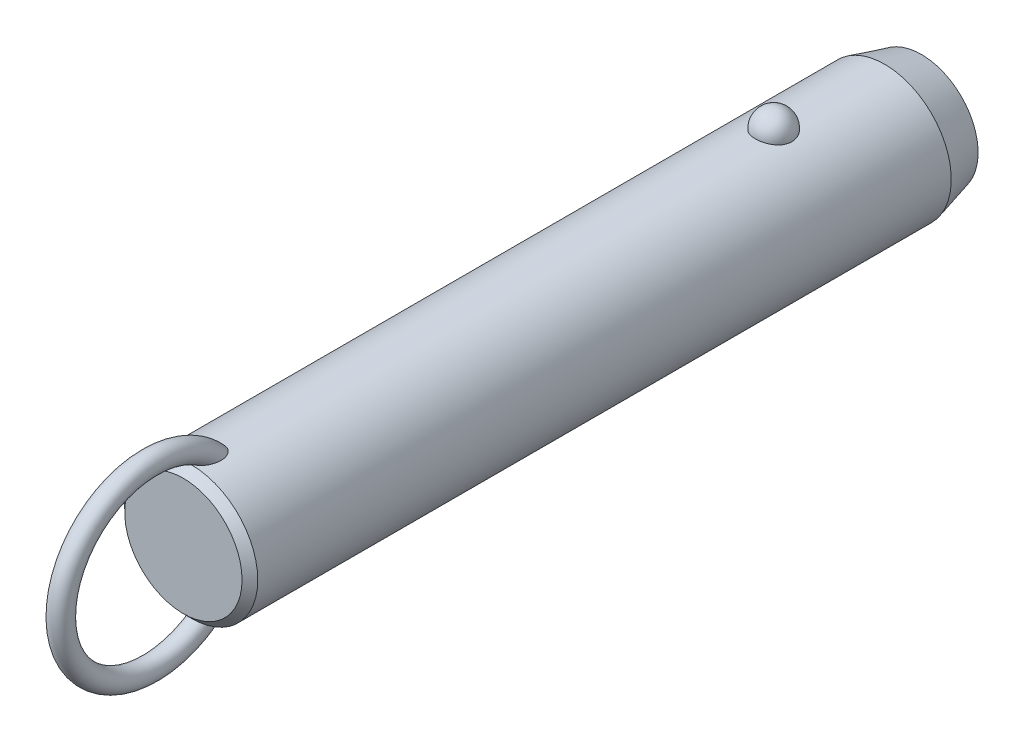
SolidWorks part; units mm, degrees
ref_plane "Front Plane" through (0, 0, 0) normal (0, 0, 1) x (1, 0, 0)
ref_plane "Top Plane" through (0, 0, 0) normal (0, 1, 0) x (1, 0, 0)
ref_plane "Right Plane" through (0, 0, 0) normal (1, 0, 0) x (0, 0, -1)
sketch "Sketch2" plane through (0, 0, 0) normal (0, 0, 1) x (1, 0, 0)
  circle A0 centre (0, 0) radius 12.7
  point P3 (0, 12.7)
  dimension "D1" = 25.4
extrude "Boss-Extrude1" add sketch "Sketch2" along normal blind 96.5
sketch "Sketch3" plane through (0, 0, 0) normal (0, 0, -1) x (-1, 0, 0)
  circle A0 centre (0, 0) radius 12.7
  dimension "D1" = 25.4
extrude "Boss-Extrude2" add sketch "Sketch3" along normal blind 31.7
chamfer "Chamfer1" distance 7 angle 15 1 edges at (-12.7, 0, -31.7)
sketch "Sketch12" plane through (0, 0, 0) normal (1, 0, 0) x (0, 0, -1)
  line L0 (-96.5, 12.7) -> (-96.5, -12.7) construction
  point P0 (-96.5, 0)
sketch "Sketch13" plane through (0, 0, 0) normal (1, 0, 0) x (0, 0, -1)
  circle A0 centre (-115.55, 0) radius 19.05
  point P2 (-96.5, 0)
  dimension "D1" = 38.1
sketch "Sketch14" plane through (0, 0, 0) normal (0, 1, 0) x (1, 0, 0)
  circle A0 centre (0, -98.5) radius 2
  point P2 (0, -96.5)
  dimension "D1" = 4
sweep "Sweep1" add profiles "Sketch14" path "Sketch13"
sketch "Sketch15" plane through (0, 0, 96.5) normal (0, 0, 1) x (1, 0, 0)
  circle A0 centre (0, 0) radius 12.7
  dimension "D1" = 25.4
extrude "Boss-Extrude3" add sketch "Sketch15" along normal blind 12.7
chamfer "Chamfer2" distance 1.5 angle 45 1 edges at (12.7, 0, 109.2)
sketch "Sketch18" plane through (0, 0, 0) normal (1, 0, 0) x (0, 0, -1)
  line L0 (24.7, 12.7) -> (-101.351, 12.7) construction
  line L1 (3.5, 16.2) -> (3.5, 9.2)
  line L2 (-101.351, -12.7) -> (24.7, -12.7) construction
  arc A0 (3.5, 16.2) -> (3.5, 9.2) centre (3.5, 12.7) ccw
  point P4 (0, 12.7)
  dimension "D1" = 28.9
revolve "Revolve1" add sketch "Sketch18" angle 360 about L1
